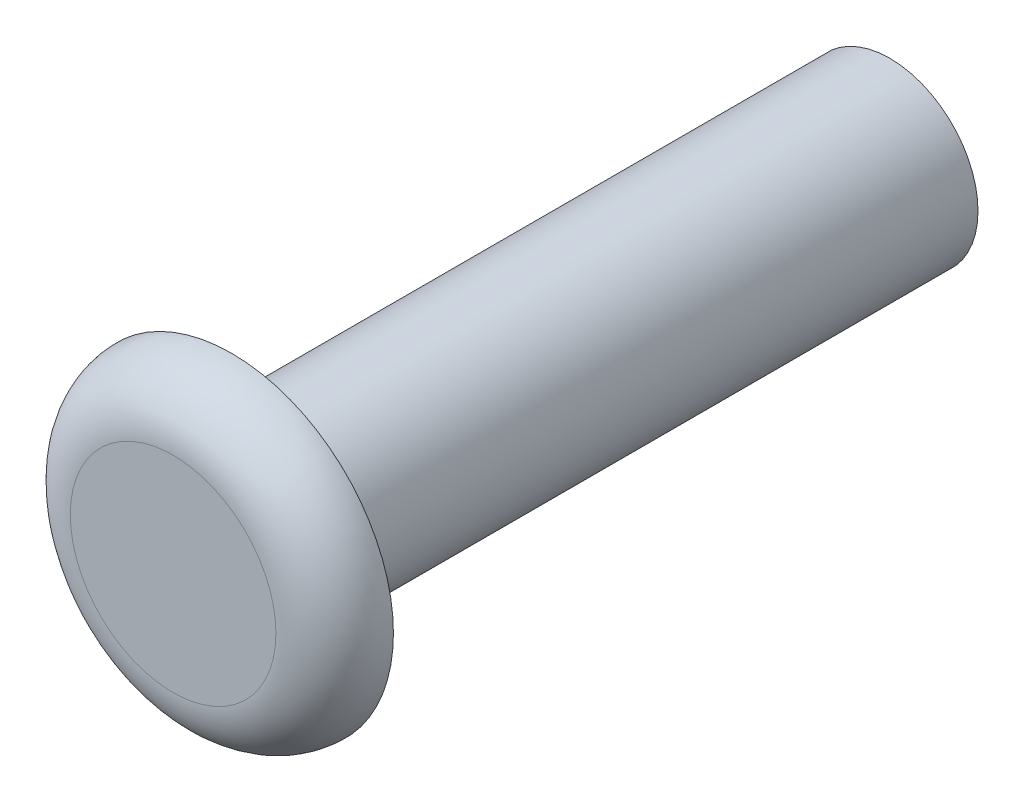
SolidWorks part; units mm, degrees
ref_plane "Front Plane" through (0, 0, 0) normal (0, 0, 1) x (1, 0, 0)
ref_plane "Top Plane" through (0, 0, 0) normal (0, 1, 0) x (1, 0, 0)
ref_plane "Right Plane" through (0, 0, 0) normal (1, 0, 0) x (0, 0, -1)
sketch "Sketch1" plane through (0, 0, 0) normal (0, 0, 1) x (1, 0, 0)
  circle A0 centre (-10.89, 3.0876) radius 1.5 construction
  circle A1 centre (-10.89, 3.0876) radius 1.5
extrude "Boss-Extrude1" add sketch "Sketch1" against normal up to surface (11.2 mm away)
sketch "Sketch2" plane through (0, 0, 0) normal (0, 0, 1) x (1, 0, 0)
  circle A0 centre (-10.89, 3.0876) radius 2.75
  dimension "D1" = 5.5
extrude "Boss-Extrude2" add sketch "Sketch2" along normal blind 1
fillet "Fillet1" radius 1 1 edges at (-8.14, 3.0876, 1)
hole_wizard "M2.5 Tapped Hole1" positions "Sketch4" profile "Sketch3" tap size "M2.5" standard "ISO"
sketch "Sketch4" plane through (0, 0, -11.2) normal (0, 0, -1) x (-1, 0, 0)
  point P0 (10.89, 3.0876)
sketch "Sketch3" plane through (-10.89, 3.0876, -11.2) normal (1, 0, 0) x (0, 1, 0)
  line L0 (0, 0) -> (0, 6.9659)
  line L1 (0, 6.9659) -> (1.025, 6.35)
  line L2 (1.025, 6.35) -> (1.025, 0)
  line L5 (1.025, 0) -> (0, 0)
  line L10 (0, 6.9659) -> (-1.025, 6.35) construction
  line L11 (0, -6.35) -> (0, 107.95) construction
  dimension "Tap Drill Dia." = 2.05
  dimension "Tap Drill Depth" = 6.35
  dimension "Drill Angle" = 118
